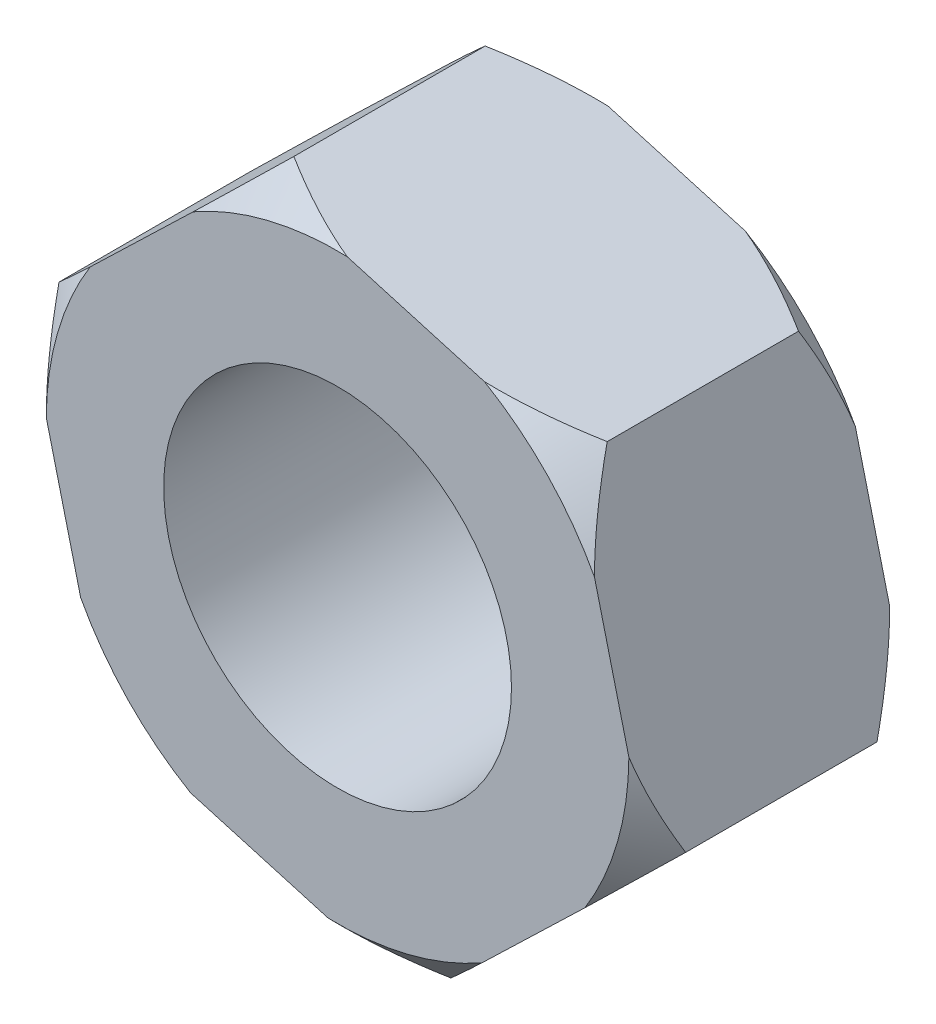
SolidWorks part; units mm, degrees
ref_plane "Плоскость1" through (0, 0, 0) normal (0, 0, 1) x (1, 0, 0)
ref_plane "Плоскость2" through (0, 0, 0) normal (0, 1, 0) x (1, 0, 0)
ref_plane "Плоскость3" through (0, 0, 0) normal (1, 0, 0) x (0, 0, -1)
sketch "Эскиз1" plane through (0, 0, 0) normal (0, 0, 1) x (1, 0, 0)
  circle A0 centre (0, 0) radius 4
  circle A1 centre (0, 0) radius 7.5
  dimension "D1" = 15
  dimension "D2" = 8
extrude "Основание-Вытянуть" add sketch "Эскиз1" along normal blind 6
chamfer "Фаска1" distance 0.8 angle 45 1 edges at (7.5, 0, 6)
chamfer "Фаска2" distance 0.8 angle 45 1 edges at (7.5, 0, 0)
sketch "Эскиз2" plane through (0, 0, 6) normal (0, 0, 1) x (1, 0, 0)
  line L1 (5.4018, 5.2029) -> (-1.805, 7.2796)
  line L2 (-1.805, 7.2796) -> (-7.2068, 2.0766)
  line L3 (-7.2068, 2.0766) -> (-5.4018, -5.2029)
  line L4 (-5.4018, -5.2029) -> (1.805, -7.2796)
  line L5 (1.805, -7.2796) -> (7.2068, -2.0766)
  line L6 (7.2068, -2.0766) -> (5.4018, 5.2029)
  circle A0 centre (0, 0) radius 6.4952 construction
  circle A1 centre (0, 0) radius 11.4055
  circle A2 centre (0, 0) radius 7.5 construction
extrude "Вырез-Вытянуть1" cut sketch "Эскиз2" against normal through all
